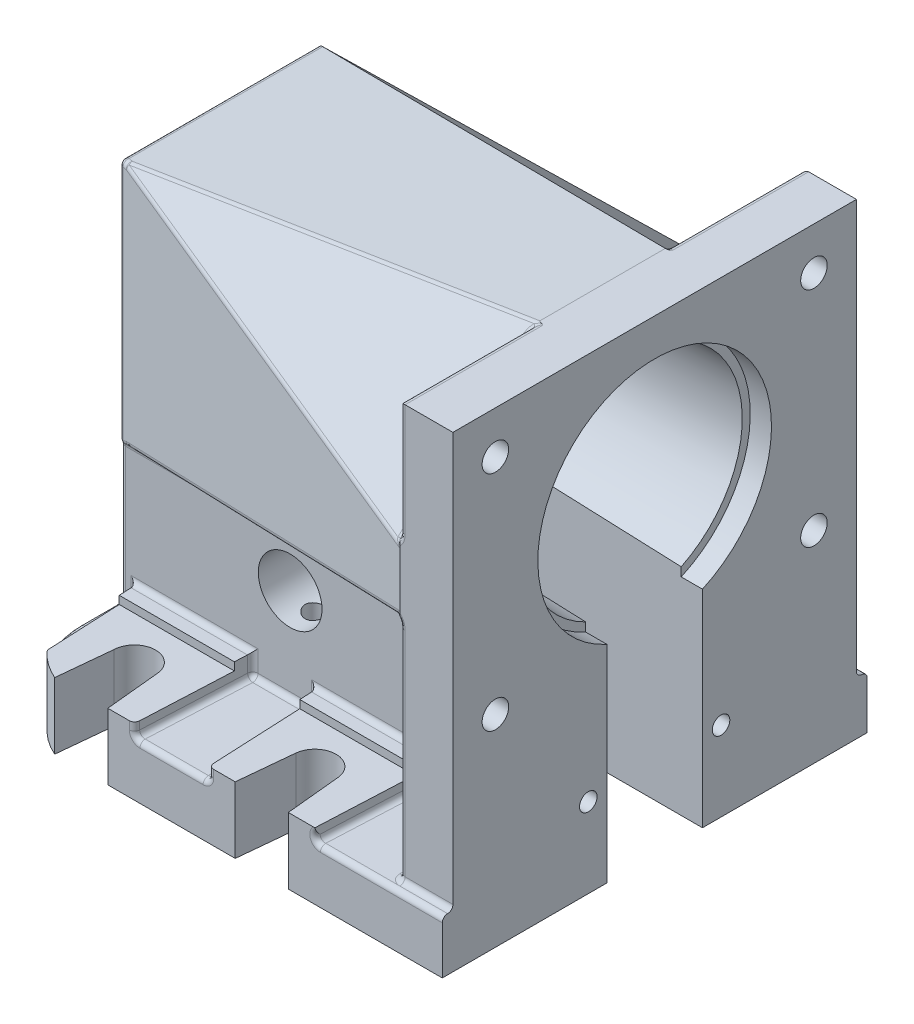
SolidWorks part; units mm, degrees
ref_plane "Plan de face" through (0, 0, 0) normal (0, 0, 1) x (1, 0, 0)
ref_plane "Plan de dessus" through (0, 0, 0) normal (0, 1, 0) x (1, 0, 0)
ref_plane "Plan de droite" through (0, 0, 0) normal (1, 0, 0) x (0, 0, -1)
sketch "Esquisse1" plane through (0, 0, 0) normal (0, 0, 1) x (1, 0, 0)
  line L1 (0, 0) -> (-10, 0)
  line L2 (0, 0) -> (0, 78)
  line L3 (0, 78) -> (-10, 78)
  line L4 (-10, 0) -> (-10, 78)
  dimension "D1" = 10
  dimension "D2" = 78
extrude "Extrusion1" add sketch "Esquisse1" along normal mid plane 76
sketch "Esquisse2" plane through (-10, 0, 0) normal (-1, 0, 0) x (0, 0, 1)
  line L0 (0, 0) -> (0, 3.5857) construction
  line L1 (0, 0) -> (0, 81.7894) construction
  line L2 (12, 78) -> (-12, 78)
  line L3 (38, 78) -> (-38, 78) construction
  line L4 (12, 78) -> (38, 54.5693)
  line L5 (38, 78) -> (38, 0) construction
  line L6 (38, 54.5693) -> (38, 43.4307)
  line L7 (38, 49) -> (-7.2359, 49) construction
  line L8 (12, 20) -> (38, 43.4307)
  line L9 (12, 20) -> (-12, 20)
  line L10 (-12, 20) -> (-38, 43.4307)
  line L11 (-38, 54.5693) -> (-38, 43.4307)
  line L12 (-12, 78) -> (-38, 54.5693)
  point P17 (0, 20)
  point P20 (0, 78)
  dimension "D1" = 24
  dimension "D2" = 35
  dimension "D3" = 58
extrude "Extrusion2" add sketch "Esquisse2" along normal blind 72
sketch "Esquisse9" plane through (0, 0, 0) normal (0, 0, 1) x (1, 0, 0)
  line L0 (-10, 78) -> (-82, 72)
  line L1 (-82, 54.5693) -> (-82, 78) construction
  line L2 (-82, 72) -> (-82, 78)
  line L3 (-82, 78) -> (-10, 78)
  line L4 (-82, 49) -> (0, 49) construction
  line L5 (-82, 43.4307) -> (-82, 54.5693) construction
  line L6 (0, 0) -> (0, 78) construction
  line L7 (-82, 26) -> (-82, 20)
  line L8 (-82, 20) -> (-10, 20)
  line L9 (-10, 20) -> (-82, 26)
  dimension "D1" = 72
extrude "Enlèv. mat.-Extru.1" cut sketch "Esquisse9" against normal through all and the other way through all
sketch "Esquisse11" plane through (0, 0, 0) normal (0, 1, 0) x (1, 0, 0)
  line L0 (-10, -38) -> (-82, -18.6579)
  line L1 (-82, -18.6579) -> (-82, -38)
  line L2 (-82, -38) -> (-10, -38)
extrude "Enlèv. mat.-Extru.3" cut sketch "Esquisse11" along normal through all
mirror "Symétrie1" about plane through (0, 0, 0) normal (0, 0, 1) of "Enlèv. mat.-Extru.3"
sketch "Esquisse12" plane through (-82, 0, 0) normal (-1, 0, 0) x (0, 0, 1)
  line L0 (38, 0) -> (-38, 0) construction
  line L1 (-18.6579, 26) -> (18.6579, 26)
  line L2 (-18.6579, 26) -> (-18.6579, 0)
  line L3 (-18.6579, 0) -> (18.6579, 0)
  line L4 (18.6579, 26) -> (18.6579, 0)
  line L5 (18.6579, 72) -> (18.6579, 26) construction
extrude "Extrusion3" add sketch "Esquisse12" against normal up to surface (72 mm away)
sketch "Esquisse13" plane through (0, 0, 0) normal (1, 0, 0) x (0, 0, -1)
  line L0 (-38, 0) -> (38, 0) construction
  line L1 (-40, 0) -> (40, 0)
  line L2 (-40, 0) -> (-40, -10)
  line L3 (-40, -10) -> (40, -10)
  line L4 (40, 0) -> (40, -10)
  line L5 (0, 0) -> (0, 23.0671) construction
  dimension "D1" = 10
  dimension "D2" = 80
extrude "Extrusion4" add sketch "Esquisse13" against normal up to surface (82 mm away)
sketch "Esquisse15" plane through (0, 0, 0) normal (0, 1, 0) x (-1, 0, 0)
  line L0 (58, 40) -> (78, 40)
  line L1 (82, 40) -> (0, 40) construction
  line L2 (78, 40) -> (79, 18.6579)
  line L4 (10, 18.6579) -> (82, 18.6579) construction
  line L5 (57, 18.6579) -> (58, 40)
  line L6 (68, 40) -> (68, 9.4909) construction
  line L7 (82, -40) -> (82, 40) construction
  line L9 (79, 18.6579) -> (57, 18.6579)
  point P10 (82, 0)
  dimension "D1" = 20
  dimension "D2" = 22
  dimension "D3" = 14
extrude "Extrusion5" add sketch "Esquisse15" along normal blind 4
fillet "Congé44" radius 1 1 edges at (-68, 4, 40)
sketch "Esquisse16" plane through (0, 0, 40) normal (0, 0, 1) x (1, 0, 0)
  line L3 (-80.031, 7.5) -> (-50.8371, 7.5)
  line L4 (-80.031, 7.5) -> (-80.031, 2.5)
  line L5 (-80.031, 2.5) -> (-50.8371, 2.5)
  line L6 (-50.8371, 7.5) -> (-50.8371, 2.5)
  line L8 (-58, 0) -> (0, 0) construction
  dimension "D1" = 2.5
  dimension "D2" = 5
extrude "Enlèv. mat.-Extru.4" cut sketch "Esquisse16" against normal blind 18
sketch "Esquisse19" plane through (0, 2.5, 0) normal (0, 1, 0) x (-1, 0, 0)
  line L0 (68, 40) -> (68, 4.5766) construction
  line L1 (82, 18.6579) -> (82, -18.6579) construction
  line L3 (63, 40) -> (64.0191, 29.6096)
  line L4 (78, 40) -> (58, 40) construction
  line L5 (73, 40) -> (71.9976, 29.8604)
  line L6 (73, 40) -> (63, 40)
  arc A1 (64.0191, 29.6096) -> (71.9976, 29.8604) centre (68, 30) ccw
  point P12 (68, 40)
  dimension "D1" = 4
  dimension "D2" = 14
  dimension "D3" = 10
  dimension "D4" = 5.646
  dimension "D5" = 10
extrude "Enlèv. mat.-Extru.5" cut sketch "Esquisse19" against normal through all
sketch "Esquisse20" plane through (0, 0, 0) normal (0, 0, 1) x (1, 0, 0)
  line L0 (-82, 49) -> (14.0498, 49) construction
  line L1 (0, 71) -> (-4, 71)
  line L2 (0, 0) -> (0, 78) construction
  line L3 (-4, 71) -> (-4, 69.5)
  line L4 (-4, 69.5) -> (-56.9904, 67.6495)
  line L6 (-75, 49) -> (0, 49)
  line L7 (0, 49) -> (0, 71)
  line L12 (-82, 72) -> (-82, 26) construction
  arc A0 (-56.9904, 67.6495) -> (-75, 49) centre (-56.3391, 49) ccw
  dimension "D1" = 44
  dimension "D5" = 7
  dimension "D2" = 4
  dimension "D3" = 41
  dimension "D4" = 2
revolve "Enlèvement de matière-Révolution1" cut sketch "Esquisse20" angle 360 about L0
sketch "Esquisse21" plane through (0, 0, 0) normal (1, 0, 0) x (0, 0, -1)
  line L0 (-40, -10) -> (40, -10) construction
  line L1 (-9, -10) -> (9, -10)
  line L2 (-9, -10) -> (-9, 34.5)
  line L3 (-9, 34.5) -> (9, 34.5)
  line L4 (9, -10) -> (9, 34.5)
  line L5 (-40, 0) -> (-40, -10) construction
  line L6 (40, -10) -> (40, 0) construction
  dimension "D1" = 31
  dimension "D2" = 31
  dimension "D3" = 44.5
extrude "Enlèv. mat.-Extru.6" cut sketch "Esquisse21" against normal through all
sketch "Esquisse22" plane through (-82, 0, 0) normal (-1, 0, 0) x (0, 0, 1)
  line L0 (9, 34.5) -> (9, -10) construction
  line L1 (-9, 34.5) -> (9, 34.5)
  line L2 (-9, 34.5) -> (-9, 53.5)
  line L3 (-3, 59.5) -> (-2.5, 59.5)
  line L4 (9, 34.5) -> (9, 53.5)
  line L5 (-2.5, 59.5) -> (-2.5, 62)
  line L6 (0, 0) -> (0, 73.3742) construction
  line L7 (2.5, 62) -> (2.5, 59.5)
  line L8 (2.5, 59.5) -> (3, 59.5)
  arc A0 (-2.5, 62) -> (2.5, 62) centre (0, 62) cw
  arc A1 (9, 53.5) -> (3, 59.5) centre (3, 53.5) ccw
  arc A2 (-9, 53.5) -> (-3, 59.5) centre (-3, 53.5) cw
  dimension "D1" = 6
  dimension "D4" = 2.5
  dimension "D2" = 25
  dimension "D3" = 2.5
extrude "Enlèv. mat.-Extru.7" cut sketch "Esquisse22" against normal blind 5
mirror "Symétrie5" about plane through (0, 0, 0) normal (0, 0, 1) of "Enlèv. mat.-Extru.5", "Enlèv. mat.-Extru.4", "Congé44", "Extrusion5"
ref_plane "Plan2" through (-51, 0, 0) normal (-1, 0, 0) x (0, 0, 1)
mirror "Symétrie6" about plane through (-51, 0, 0) normal (-1, 0, 0) of "Symétrie5", "Extrusion5", "Enlèv. mat.-Extru.4", "Enlèv. mat.-Extru.5"
sketch "Esquisse23" plane through (0, 0, 0) normal (1, 0, 0) x (0, 0, -1)
  line L0 (0, 49) -> (-57.2839, 49) construction
  line L1 (0, 0) -> (0, 85.3445) construction
  line L2 (-38, 78) -> (38, 78) construction
  line L3 (-38, 0) -> (-38, 78) construction
  circle A0 centre (-30, 70) radius 2.5
  circle A1 centre (-30, 28) radius 2.5
  circle A2 centre (30, 70) radius 2.5
  circle A3 centre (30, 28) radius 2.5
  dimension "D2" = 5
  dimension "D1" = 8
  dimension "D3" = 8
extrude "Enlèv. mat.-Extru.8" cut sketch "Esquisse23" against normal through all
fillet "Congé46" radius 15 2 edges at (-82, -5, 40) (-82, -5, -40)
hole_wizard "Trou taraudé M4x0.71" positions "Esquisse25" profile "Esquisse24" tap size "M4x0.7" standard "Ansi Métrique"
sketch "Esquisse25" plane through (0, 0, 0) normal (1, 0, 0) x (0, 0, -1)
  line L0 (-40, -10) -> (-9, -10) construction
  point P0 (-12.5, 5)
  dimension "D1" = 15
  dimension "D2" = 12.5
sketch "Esquisse24" plane through (0, 5, 12.5) normal (0, 1, 0) x (0, 0, -1)
  line L0 (0, 0) -> (0, 11.0914)
  line L1 (0, 11.0914) -> (1.65, 10.1)
  line L2 (1.65, 10.1) -> (1.65, 0)
  line L5 (1.65, 0) -> (0, 0)
  line L10 (0, 11.0914) -> (-1.65, 10.1) construction
  line L11 (0, -6.35) -> (0, 107.95) construction
  dimension "Diamètre du trou pour taraudage" = 3.3
  dimension "Profondeur du trou pour taraudage" = 10.1
  dimension "Angle de pointe" = 118
mirror "Symétrie7" about plane through (0, 0, 0) normal (0, 0, 1) of "Trou taraudé M4x0.71"
sketch "Esquisse27" plane through (0, 0, 0) normal (0, 0, 1) x (1, 0, 0)
  line L1 (0, 0) -> (0, 78) construction
  circle A0 centre (-50, 17.5) radius 6
  circle A1 centre (-23.464, 49) radius 6 construction
  dimension "D3" = 12
  dimension "D1" = 31.5
  dimension "D2" = 50
extrude "Enlèv. mat.-Extru.9" cut sketch "Esquisse27" against normal through all and the other way through all
sketch "Esquisse28" plane through (0, -10, 0) normal (0, -1, 0) x (1, 0, 0)
  line L0 (-44, 9) -> (-44, 18.6579) construction
  line L1 (-82, 9) -> (0, 9) construction
  circle A0 centre (-50, 13.83) radius 2
  dimension "D1" = 4
  dimension "D2" = 6
  dimension "D3" = 4.83
extrude "Enlèv. mat.-Extru.10" cut sketch "Esquisse28" against normal up to next
sketch "Esquisse29" plane through (0, -10, 0) normal (0, -1, 0) x (1, 0, 0)
  circle A0 centre (-50, 13.83) radius 3
  dimension "D1" = 6
extrude "Enlèv. mat.-Extru.11" cut sketch "Esquisse29" against normal blind 12
fillet "Congé54" radius 1 1 edges
fillet "Congé55" radius 1 1 edges
fillet "Congé56" radius 1 1 edges
fillet "Congé57" radius 1 2 edges at (-81.4583, 72.0451, 18.579)
fillet "Congé58" radius 1 4 edges at (-10, 54.531, 37.9041) (-9.309, 77.9511, 11.9992) (-9.9052, 77.4251, 12.638)
fillet "Congé60" radius 1 1 edges
fillet "Congé61" radius 1 6 edges at (-51, 0, 40) (-57.5, 0, 29.329) (-58, 1.25, 40) (-44.5, 0, 29.329) (-44, 1.25, 40)
fillet "Congé65" radius 1 3 edges at (-81.0112, 0, 31.6081) (-78.1753, 1.25, 36.2579)
fillet "Congé66" radius 1 2 edges at (-81.7071, -0.2929, 18.6579)
fillet "Congé68" radius 1 5 edges at (-79, 2.5, 18.6579) (-78.9863, 0.2929, 18.9508) (-78.1003, -0.6952, 36.2701) (-78.2083, -0.1753, 35.5543) (-78.6036, 0, 27.1189)
fillet "Congé69" radius 1 1 edges at (-68.4771, 4, 18.6579)
fillet "Congé70" radius 1 2 edges at (-56.7205, 0.2929, 18.9508) (-57, 3, 18.6579)
fillet "Congé71" radius 1 2 edges at (-45.2795, 0.2929, 18.9508) (-45, 2.5, 18.6579)
fillet "Congé72" radius 1 1 edges at (-34.4771, 4, 18.6579)
fillet "Congé73" radius 1 1 edges at (-23, 2.5, 18.6579)
fillet "Congé74" radius 1 1 edges at (-46, 26, 18.6579)
fillet "Congé75" radius 1 4 edges at (-82, 0.2321, 18.7473) (-81.6785, 25.9616, 18.7443)
fillet "Congé76" radius 1 4 edges at (-82, 72, -0.5066) (-82, 71.7137, 18.3625) (-81.1113, 26.0725, 18.7949) (-82, 49.1526, 18.6579)
fillet "Congé77" radius 1 4 edges at (-10, 12.7775, 18.6579) (-10, 25.9616, 18.7443) (-10, 43.469, 37.9041)
fillet "Congé78" radius 1 1 edges
fillet "Congé83" radius 1 1 edges at (-78.1753, 1.25, -36.2579)
fillet "Congé86" radius 1 2 edges at (-80.9431, 0, -31.783)
fillet "Congé87" radius 1 1 edges
fillet "Congé88" radius 1 2 edges at (-81.7071, 25.736, -18.365) (-45.5, 26, -18.6579)
fillet "Congé89" radius 1 3 edges at (-80.8872, 26.2681, -18.9569)
fillet "Congé90" radius 1 1 edges
fillet "Congé91" radius 1 1 edges at (-82, 48.7161, -18.6579)
fillet "Congé92" radius 1 3 edges at (-78.1003, -0.6952, -36.2701) (-78.2134, -0.134, -35.4453) (-78.627, 0, -26.6189)
fillet "Congé93" radius 1 4 edges at (-81.7071, -0.2929, -18.365) (-79.2932, 0.2929, -18.6579) (-79, 2.5, -18.6579)
fillet "Congé94" radius 1 1 edges at (-68.4771, 4, -18.6579)
fillet "Congé95" radius 1 6 edges at (-51, 0, -40) (-57.5, 0, -29.329) (-58, 1.25, -40) (-44.5, 0, -29.329) (-44, 1.25, -40)
fillet "Congé96" radius 1 11 edges at (-12, 0, 40) (-24, 1.25, 40) (-23.5223, 0, 29.8056) (-22.7361, 0, 18.9345) (-10.2929, 0, 18.9508) (-10, 0, 28.329) (-9.7071, 0, 37.7071)
fillet "Congé97" radius 1 1 edges at (-34, 4, -18.6579)
fillet "Congé98" radius 1 2 edges at (-45.2795, 0.2929, -18.9508) (-45, 3, -18.6579)
fillet "Congé99" radius 1 8 edges at (-10, 0, -28.329) (-12, 0, -40) (-23.5, 0, -29.329) (-24, 1.25, -40)
fillet "Congé100" radius 1 1 edges at (-23.9924, 2.0161, -39.8372)
fillet "Congé101" radius 1 2 edges at (-22.7205, 0.2929, -18.9508) (-23, 3, -18.6579)
fillet "Congé102" radius 1 3 edges at (-9.7071, 77.7071, -12.325) (-10, 54.531, -37.9041)
fillet "Congé103" radius 1 5 edges at (-10, 43.469, -37.9041) (-10.2929, 0.2929, -18.9508) (-10, 13.2775, -18.6579) (-10, 25.9616, -18.7443)
fillet "Congé106" radius 1 1 edges
fillet "Congé107" radius 1 1 edges
hole_wizard "Trou taraudé M3x0.51" positions "Esquisse31" profile "Esquisse30" tap size "M3x0.5" standard "Ansi Métrique"
sketch "Esquisse31" plane through (-82, 0, 0) normal (-1, 0, 0) x (0, 0, 1)
  line L0 (9, -10) -> (26.2523, -10) construction
  point P0 (12.5, 64)
  point P8 (-12.5, 64)
  point P11 (-12.5, 38)
  point P13 (12.5, 38)
  dimension "D1" = 12.5
  dimension "D2" = 74
  dimension "D3" = 25
  dimension "D4" = 26
  dimension "D5" = 26
sketch "Esquisse30" plane through (-82, 64, 12.5) normal (0, 1, 0) x (0, 0, 1)
  line L0 (0, 0) -> (0, 8.2511)
  line L1 (0, 8.2511) -> (1.25, 7.5)
  line L2 (1.25, 7.5) -> (1.25, 0.25)
  line L3 (1.25, 0.25) -> (1.5, 0)
  line L5 (1.5, 0) -> (0, 0)
  line L6 (-1.25, 0.25) -> (-1.5, 0) construction
  line L10 (0, 8.2511) -> (-1.25, 7.5) construction
  line L11 (0, -6.35) -> (0, 107.95) construction
  dimension "Diamètre du trou pour taraudage" = 2.5
  dimension "Profondeur du trou pour taraudage" = 7.5
  dimension "Diamètre du fraisage entrant" = 3
  dimension "Angle du fraisage entrant" = 90
  dimension "Angle de pointe" = 118
